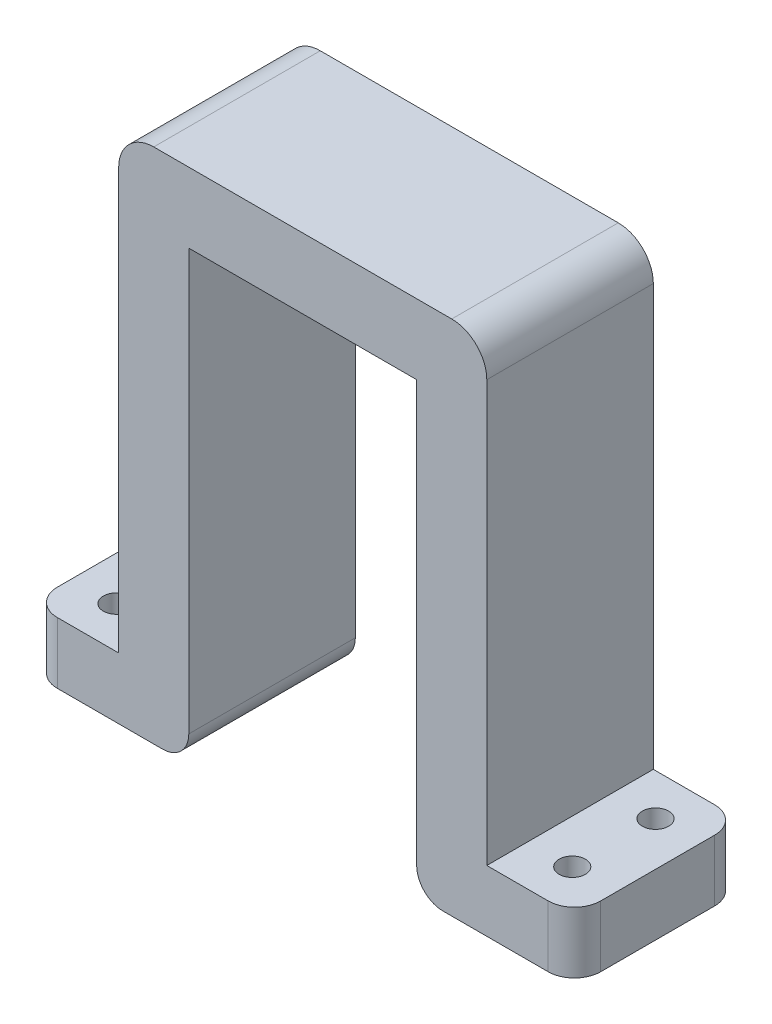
SolidWorks part; units mm, degrees
ref_plane "Front Plane" through (0, 0, 0) normal (0, 0, 1) x (1, 0, 0)
ref_plane "Top Plane" through (0, 0, 0) normal (0, 1, 0) x (1, 0, 0)
ref_plane "Right Plane" through (0, 0, 0) normal (1, 0, 0) x (0, 0, -1)
sketch "Sketch1" plane through (0, 0, 0) normal (0, 0, 1) x (1, 0, 0)
  line L0 (-11.7833, 7.4926) -> (14.2167, 7.4926)
  line L1 (14.2167, 7.4926) -> (14.2167, -43.5074)
  line L2 (-11.7833, 7.4926) -> (-11.7833, -43.5074)
  line L3 (-11.7833, -43.5074) -> (-19.7833, -43.5074)
  line L4 (14.2167, -43.5074) -> (22.2167, -43.5074)
  line L5 (-19.7833, -43.5074) -> (-19.7833, 15.4926)
  line L6 (22.2167, -43.5074) -> (22.2167, 15.4926)
  line L7 (22.2167, 15.4926) -> (-19.7833, 15.4926)
  dimension "D1" = 26
  dimension "D2" = 51
  dimension "D3" = 51
  dimension "D4" = 8
  dimension "D5" = 8
  dimension "D6" = 59
extrude "Boss-Extrude1" add sketch "Sketch1" along normal blind 19 contours L5 L7 L6 L4 L1 L0 L2 L3
sketch "Sketch2" plane through (22.2167, 0, 0) normal (1, 0, 0) x (0, 0, -1)
  line L0 (0, -43.5074) -> (0, 15.4926) construction
  line L1 (-19, -43.5074) -> (0, -43.5074)
  line L2 (-19, -43.5074) -> (-19, -36.5074)
  line L3 (-19, -36.5074) -> (0, -36.5074)
  line L4 (0, -43.5074) -> (0, -36.5074)
  dimension "D1" = 7
sketch "Sketch3" plane through (-19.7833, 0, 0) normal (-1, 0, 0) x (0, 0, 1)
  line L0 (19, -43.5074) -> (19, 15.4926) construction
  line L1 (0, -43.5074) -> (19, -43.5074)
  line L2 (0, -43.5074) -> (0, -36.5074)
  line L3 (0, -36.5074) -> (19, -36.5074)
  line L4 (19, -43.5074) -> (19, -36.5074)
  dimension "D1" = 7
extrude "Boss-Extrude2" add sketch "Sketch3" along normal blind 10
extrude "Boss-Extrude3" add sketch "Sketch2" along normal blind 10 contours L2 L3 L4 L1
sketch "Sketch5" plane through (0, -36.5074, 0) normal (0, 1, 0) x (1, 0, 0)
  line L1 (-29.7833, 0) -> (-19.7833, 0) construction
  line L4 (-24.7833, 0) -> (-24.3881, 0.0768)
  circle A0 centre (-24.7833, -4.75) radius 1.5
  circle A1 centre (-24.7833, -14.25) radius 1.5
  dimension "D1" = 3
sketch "Sketch6" plane through (0, -36.5074, 0) normal (0, 1, 0) x (1, 0, 0)
  circle A0 centre (27.2167, -14.25) radius 1.5
  circle A1 centre (27.2167, -4.75) radius 1.5
  dimension "D1" = 3
extrude "Cut-Extrude1" cut sketch "Sketch6" against normal through all
extrude "Cut-Extrude2" cut sketch "Sketch5" against normal through all contours A1 | A0
fillet "Fillet1" radius 3 4 edges at (32.2167, -40.0074, 19) (32.2167, -40.0074, 0) (-29.7833, -40.0074, 0) (-29.7833, -40.0074, 19)
fillet "Fillet2" radius 4 2 edges at (-19.7833, 15.4926, 9.5) (22.2167, 15.4926, 9.5)
fillet "Fillet3" radius 3 2 edges at (14.2167, -43.5074, 9.5) (-11.7833, -43.5074, 9.5)
